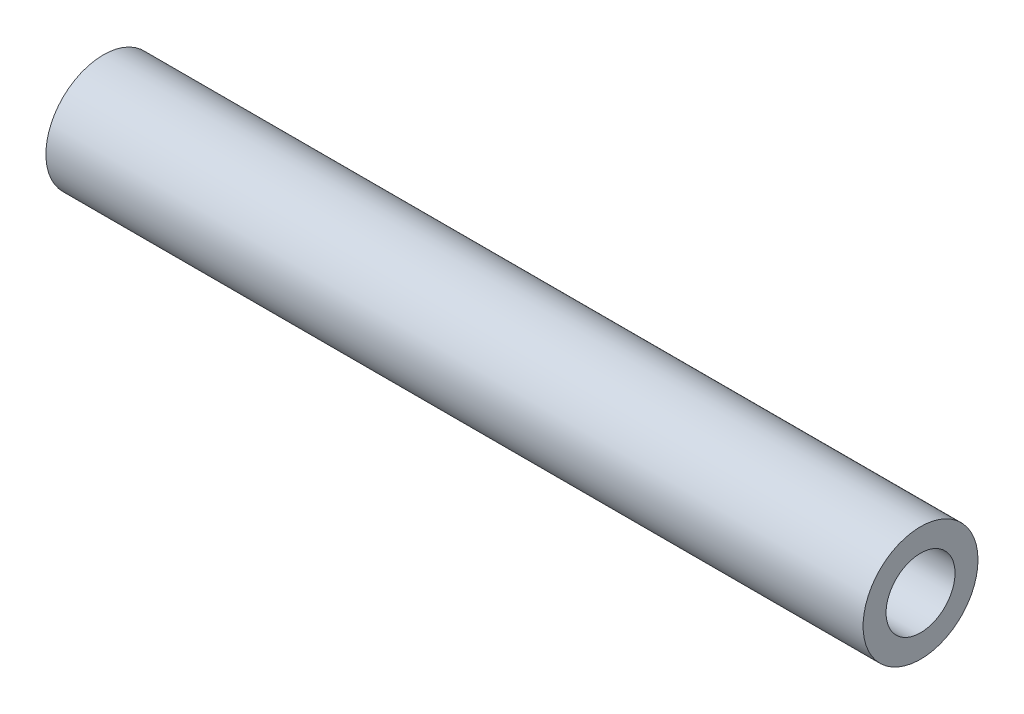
SolidWorks part; units mm, degrees
ref_plane "Plan de face" through (0, 0, 0) normal (0, 0, 1) x (1, 0, 0)
ref_plane "Plan de dessus" through (0, 0, 0) normal (0, 1, 0) x (1, 0, 0)
ref_plane "Plan de droite" through (0, 0, 0) normal (1, 0, 0) x (0, 0, -1)
sketch "Esquisse1" plane through (0, 0, 0) normal (1, 0, 0) x (0, 0, -1)
  circle A0 centre (0, 0) radius 2
  circle A1 centre (0, 0) radius 1.2
  dimension "D1" = 2.4
  dimension "D2" = 4
sketch "Esquisse2" plane through (0, 0, 0) normal (0, 1, 0) x (1, 0, 0)
  spline S0 degree 3 poles (0, 0) (-0.5783, 0) (-1.8725, 0) (-3.7633, 0) (-5.4339, 0) (-6.8474, 0) (-8.0131, 0) (-9.1972, 0) (-10.2711, 0) (-16.696, 0) (-22.7445, 0) (-28.4442, 0) knots 0 0 0 0 0.060989 0.1365 0.199426 0.237181 0.285585 0.322373 0.362064 0.398851 1 1 1 1
sweep "Balayage1" add profiles "Esquisse1" path "Esquisse2"
